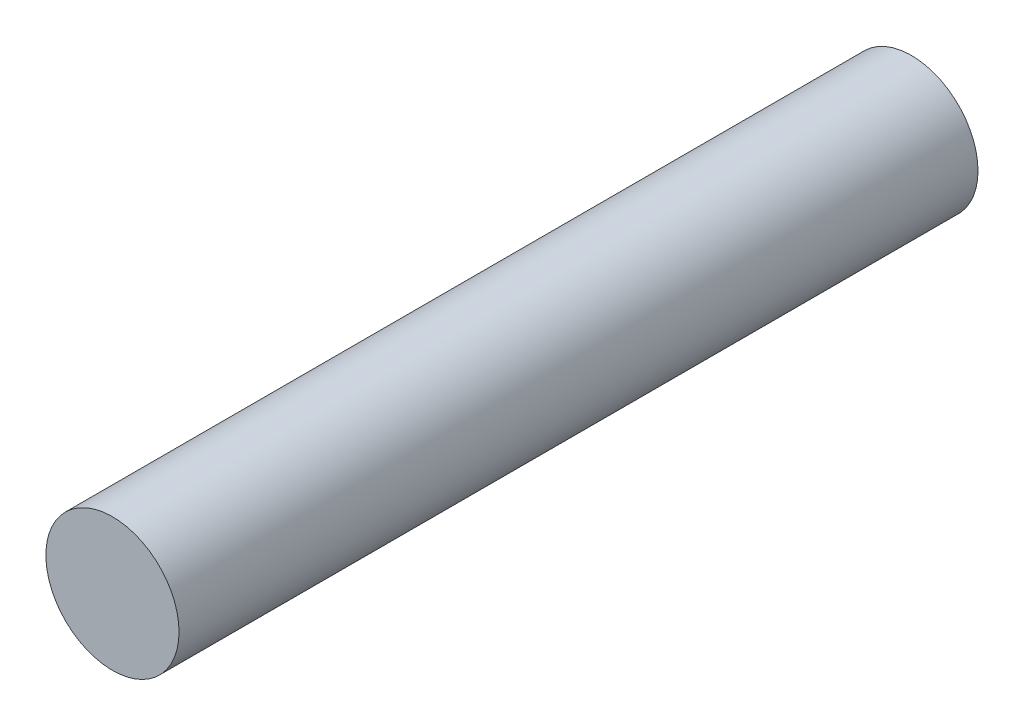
SolidWorks part; units mm, degrees
ref_plane "Front" through (0, 0, 0) normal (0, 0, 1) x (1, 0, 0)
ref_plane "Top" through (0, 0, 0) normal (0, 1, 0) x (1, 0, 0)
ref_plane "Right" through (0, 0, 0) normal (1, 0, 0) x (0, 0, -1)
sketch "Sketch2" plane through (0, 0, 0) normal (0, 0, 1) x (1, 0, 0)
  circle A0 centre (0, 0) radius 50.8
extrude "Base-Extrude" add sketch "Sketch2" against normal blind 609.6
